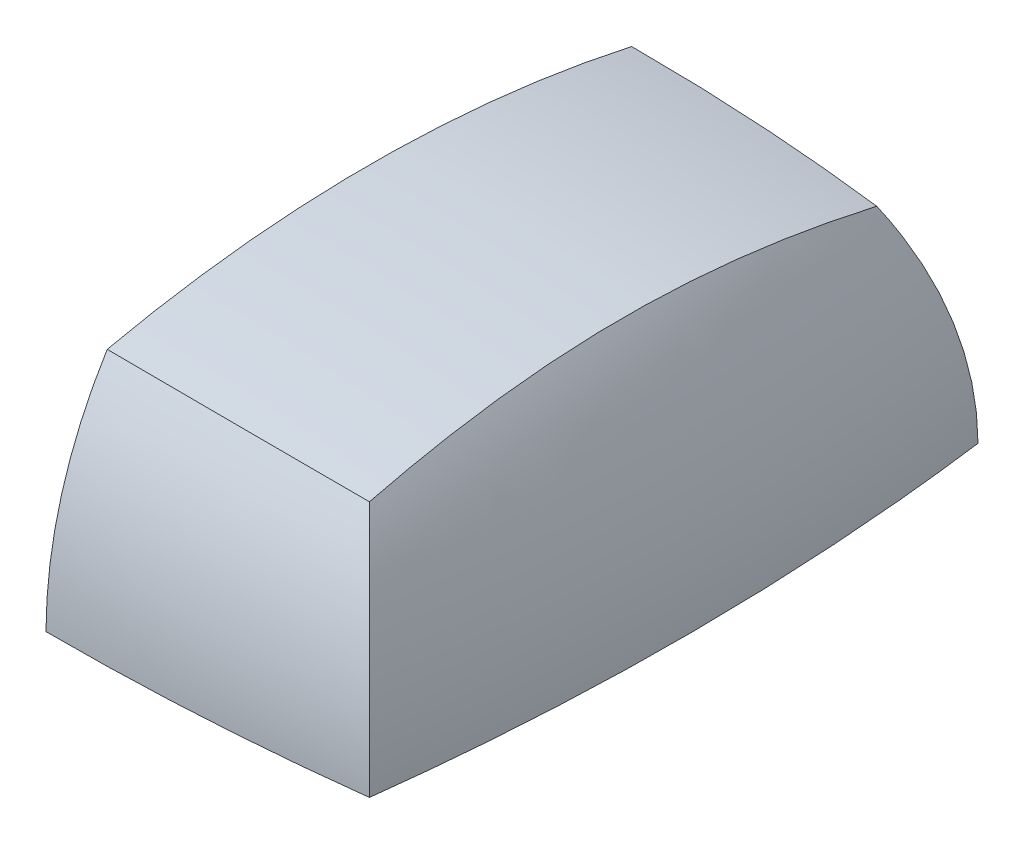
SolidWorks part; units mm, degrees
ref_plane "Front Plane" through (0, 0, 0) normal (0, 0, 1) x (1, 0, 0)
ref_plane "Top Plane" through (0, 0, 0) normal (0, 1, 0) x (1, 0, 0)
ref_plane "Right Plane" through (0, 0, 0) normal (1, 0, 0) x (0, 0, -1)
sketch "Sketch1" plane through (0, 0, 0) normal (0, 1, 0) x (1, 0, 0)
  arc A0 (0, 200) -> (250, 180) centre (5.8009, -1299.9888) cw
  dimension "D2" = 180
  dimension "D4" = 1500
  dimension "D1" = 200
  dimension "D3" = 250
sketch "Sketch2" plane through (0, 0, 0) normal (1, 0, 0) x (0, 0, -1)
  arc A0 (200, 0) -> (146.1505, 155) centre (-50, 0) ccw
  dimension "D2" = 250
  dimension "D1" = 155
surface "Surface-Sweep1"
move or copy body "Body-Move/Copy1" bodies to move or copy 101 copy yes number of copies 1 rotation origin (0, 0, 0) rotation axis (0, -1, 0) rotation angle 90
surface "Surface-Extend1" parameters "D1"=235
mirror "Mirror1" about plane through (0, 0, 0) normal (0, 0, 1)
sketch "Sketch3" plane through (0, 0, 0) normal (1, 0, 0) x (0, 0, -1)
  line L0 (0, 150) -> (0, 0) construction
  arc A0 (-208.5672, 120.4163) -> (208.5672, 120.4163) centre (0, -600) cw
  dimension "D1" = 750
  dimension "D2" = 150
  dimension "D3" = 120
sketch "Sketch4" plane through (0, 0, 0) normal (0, 0, 1) x (1, 0, 0)
  arc A0 (0, 150) -> (243.3904, 135.135) centre (0, -1850) cw
  ellipse E0 centre (208.3465, 0) end of major axis (208.3465, 250) minor radius 41.6535 (250, 0) -> (241.0279, 155) ccw construction
  dimension "D1" = 2000
surface "Surface-Sweep2"
sketch "Sketch5" plane through (0, 0, 0) normal (0, 0, 1) x (1, 0, 0)
  line L0 (250, 0) -> (0, 0)
  line L1 (0, 0) -> (0, 200)
  line L2 (0, 0) -> (250, 0) construction
  ellipse E0 centre (208.3465, 0) end of major axis (208.3465, 250) minor radius 41.6535 (250, 0) -> (241.0279, 155) ccw construction
  dimension "D1" = 200
surface "Surface-Extrude1" sketch "Sketch5" parameters "D1"=420
other "Intersect1"
delete or keep bodies "Body-Delete/Keep 1" type delete bodies bodies 118 117 115 114 116
